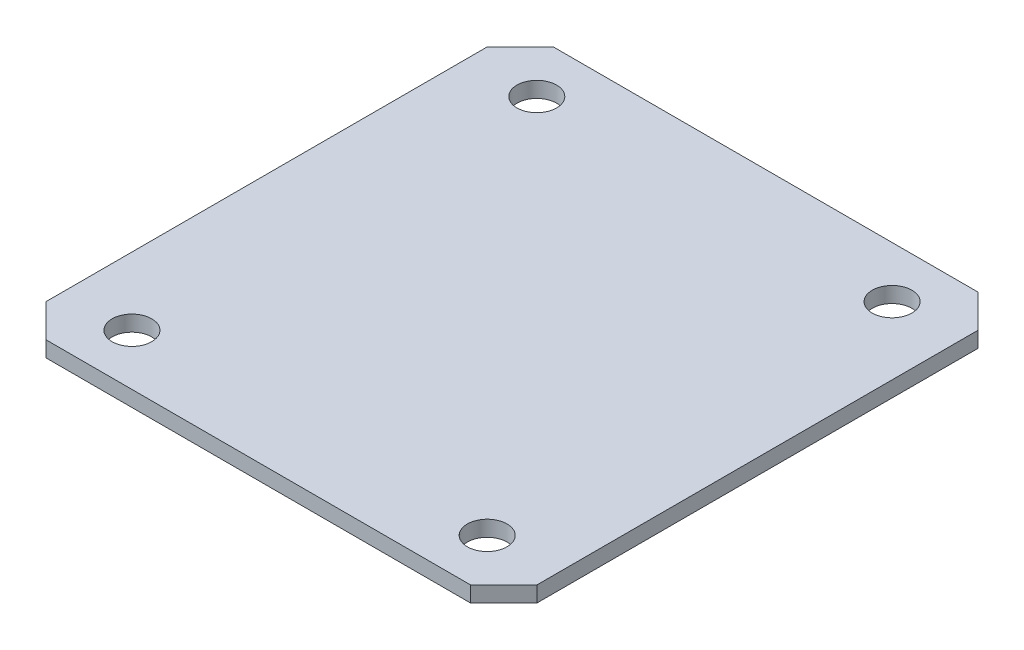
SolidWorks part; units mm, degrees
ref_plane "Front Plane" through (0, 0, 0) normal (0, 0, 1) x (1, 0, 0)
ref_plane "Top Plane" through (0, 0, 0) normal (0, 1, 0) x (1, 0, 0)
ref_plane "Right Plane" through (0, 0, 0) normal (1, 0, 0) x (0, 0, -1)
sketch "Sketch1" plane through (0, 0, 0) normal (0, 1, 0) x (1, 0, 0)
  line L1 (14.85, -15.35) -> (-14.85, -15.35)
  line L2 (14.85, -15.35) -> (14.85, 15.35)
  line L3 (14.85, 15.35) -> (-14.85, 15.35)
  line L4 (-14.85, -15.35) -> (-14.85, 15.35)
  line L5 (14.85, -15.35) -> (-14.85, 15.35) construction
  line L6 (14.85, 15.35) -> (-14.85, -15.35) construction
  point P0 (0, 0)
  dimension "D1" = 29.7
  dimension "D2" = 30.7
extrude "Boss-Extrude1" add sketch "Sketch1" along normal blind 0.95
hole_wizard "M2 Clearance Hole1" positions "Sketch3" profile "Sketch2" hole size "M2" standard "Ansi Metric"
sketch "Sketch3" plane through (0, 0.95, 0) normal (0, 1, 0) x (-1, 0, 0)
  line L0 (0.275, 0) -> (-0.275, 0) construction
  line L1 (0, 0.275) -> (0, -0.275) construction
  point P0 (10.75, 12.25)
  dimension "D1" = 12.25
  dimension "D2" = 10.75
sketch "Sketch2" plane through (-10.75, 0.95, 12.25) normal (1, 0, 0) x (0, 0, 1)
  line L0 (0, 0) -> (0, 0.95)
  line L1 (0, 0.95) -> (1.2, 0.95)
  line L2 (1.2, 0.95) -> (1.2, 0)
  line L5 (1.2, 0) -> (0, 0)
  line L11 (0, -6.35) -> (0, 107.95) construction
  dimension "Thru Hole Dia." = 2.4
  dimension "Thru Hole Depth" = 0.95
pattern_linear "LPattern1" count 2 spacing 21.5 along (1, 0, 0) count 2 spacing 24.5 along (0, 0, -1) of "M2 Clearance Hole1"
chamfer "Chamfer1" distance 2 angle 45 4 edges at (-14.85, 0.475, -15.35) (14.85, 0.475, -15.35) (14.85, 0.475, 15.35) (-14.85, 0.475, 15.35)
sketch "Sketch4" plane through (0, 0.95, 0) normal (0, 1, 0) x (-1, 0, 0)
  line L0 (-12.85, -15.35) -> (12.85, -15.35) construction
  line L1 (-14.85, 13.35) -> (-14.85, -13.35) construction
  circle A0 centre (-0.85, -0.35) radius 12.7
  dimension "D1" = 25.4
  dimension "D2" = 15
  dimension "D3" = 14
sketch "Sketch5" [suppressed] plane through (0, 0, 0) normal (0, -1, 0) x (1, 0, 0)
  line L0 (0, -0.275) -> (0, 0.275) construction
  line L1 (0.275, 0) -> (-0.275, 0) construction
  circle A0 centre (0, -0.5) radius 11.25
  dimension "D1" = 22.5
  dimension "D2" = 0.5
extrude "Cut-Extrude1" [suppressed] cut sketch "Sketch5" against normal through all
